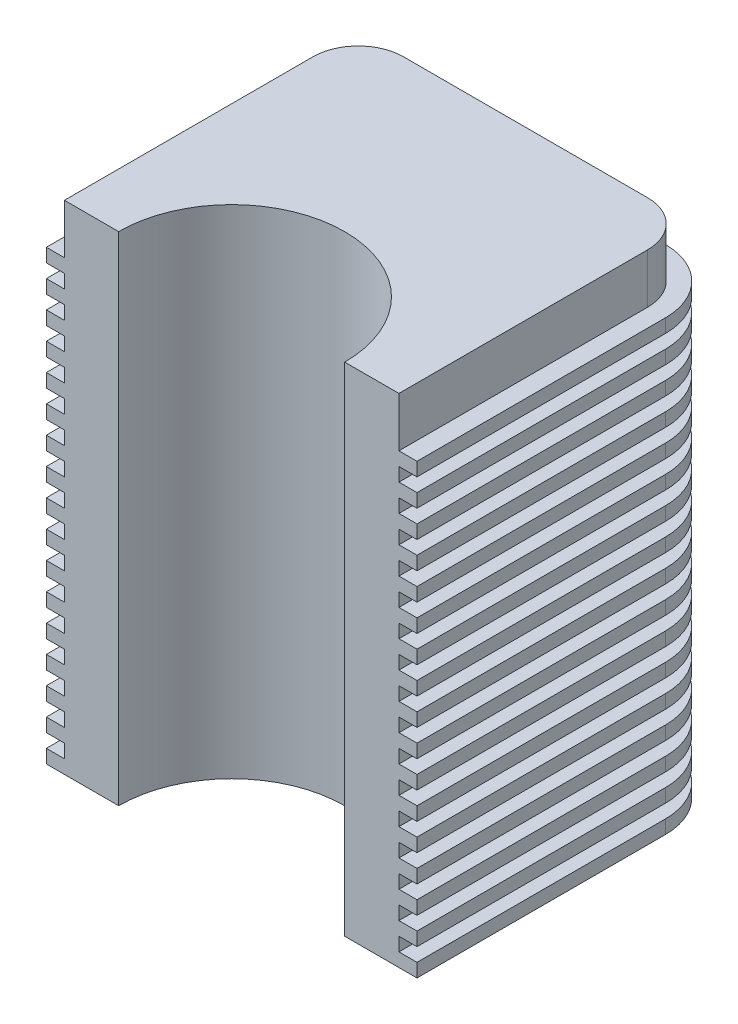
SolidWorks part; units mm, degrees
ref_plane "Front Plane" through (0, 0, 0) normal (0, 0, 1) x (1, 0, 0)
ref_plane "Top Plane" through (0, 0, 0) normal (0, 1, 0) x (1, 0, 0)
ref_plane "Right Plane" through (0, 0, 0) normal (1, 0, 0) x (0, 0, -1)
sketch "Sketch2" plane through (0, 0, 0) normal (0, 1, 0) x (1, 0, 0)
  line L0 (25, 0) -> (37, 0)
  line L1 (37, 0) -> (37, 55)
  line L2 (27, 65) -> (-27, 65)
  line L3 (0, 0) -> (0, 43.7103) construction
  line L4 (-25, 0) -> (-37, 0)
  line L5 (-37, 0) -> (-37, 55)
  arc A0 (25, 0) -> (-25, 0) centre (0, 0) ccw
  arc A1 (37, 55) -> (27, 65) centre (27, 55) ccw
  arc A2 (-37, 55) -> (-27, 65) centre (-27, 55) cw
  point P11 (0, 65)
  point P13 (37, 65)
  point P16 (-37, 65)
  dimension "D1" = 50
  dimension "D4" = 10
  dimension "D2" = 12
  dimension "D3" = 65
extrude "Boss-Extrude1" add sketch "Sketch2" along normal blind 110
sketch "Sketch3" plane through (0, 0, 0) normal (0, -1, 0) x (1, 0, 0)
  line L1 (41, -55) -> (41, 0)
  line L2 (-27, -69) -> (27, -69)
  line L3 (-41, 0) -> (-41, -55)
  line L5 (-25, 0) -> (-37, 0)
  line L6 (-37, 0) -> (-37, -55)
  line L7 (-27, -65) -> (27, -65)
  line L8 (37, -55) -> (37, 0)
  line L9 (37, 0) -> (25, 0)
  line L10 (-25, 0) -> (-37, 0)
  line L11 (-37, 0) -> (-37, -55)
  line L12 (-27, -65) -> (27, -65)
  line L13 (37, -55) -> (37, 0)
  line L14 (37, 0) -> (25, 0)
  line L15 (-37, 0) -> (-41, 0)
  line L16 (37, 0) -> (41, 0)
  line L17 (-41, 4) -> (-41, -55) construction
  line L18 (-20.6155, 4) -> (-41, 4) construction
  line L19 (41, 4) -> (20.6155, 4) construction
  line L20 (41, -55) -> (41, 4) construction
  arc A1 (27, -69) -> (41, -55) centre (27, -55) ccw
  arc A2 (-41, -55) -> (-27, -69) centre (-27, -55) ccw
  arc A3 (-25, 0) -> (25, 0) centre (0, 0) ccw
  arc A4 (-37, -55) -> (-27, -65) centre (-27, -55) ccw
  arc A5 (27, -65) -> (37, -55) centre (27, -55) ccw
  arc A6 (-25, 0) -> (25, 0) centre (0, 0) ccw
  arc A7 (-37, -55) -> (-27, -65) centre (-27, -55) ccw
  arc A8 (27, -65) -> (37, -55) centre (27, -55) ccw
  arc A9 (-20.6155, 4) -> (20.6155, 4) centre (0, 0) ccw construction
  dimension "D1" = 0
  dimension "D2" = 4
extrude "Boss-Extrude2" add sketch "Sketch3" against normal blind 3 contours L3 A2 L2 A1 L1 L16 L15 M23 M22 M21 M20 M19
pattern_linear "LPattern1" count 17 spacing 6 along (0, 1, 0) of "Boss-Extrude2"
